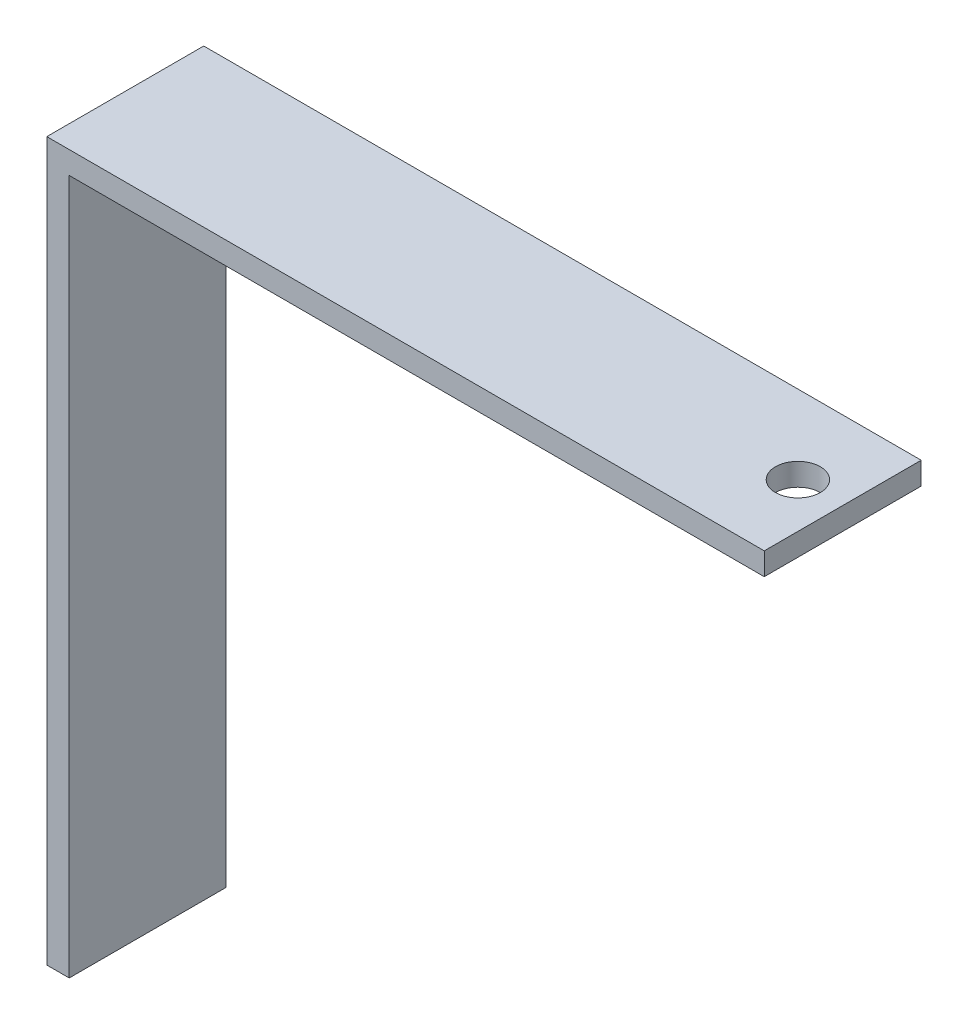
SolidWorks part; units mm, degrees
ref_plane "Front Plane" through (0, 0, 0) normal (0, 0, 1) x (1, 0, 0)
ref_plane "Top Plane" through (0, 0, 0) normal (0, 1, 0) x (1, 0, 0)
ref_plane "Right Plane" through (0, 0, 0) normal (1, 0, 0) x (0, 0, -1)
sketch "Sketch1" plane through (0, 0, 0) normal (0, 0, 1) x (1, 0, 0)
  line L0 (0, 0) -> (0, 101.6)
  line L1 (0, 101.6) -> (101.6, 101.6)
  dimension "D1" = 101.6
extrude "Extrude-Thin1" add sketch "Sketch1" along normal blind 22.225 thin
sketch "Sketch3" plane through (0, 101.6, 0) normal (0, 1, 0) x (1, 0, 0)
  line L0 (0, -22.225) -> (0, 0) construction
  line L1 (106.4523, -11.1125) -> (86.088, -11.1125) construction
  line L2 (101.6, -22.225) -> (101.6, 0) construction
  circle A0 centre (95.25, -11.1125) radius 3.175
  point P8 (101.6, -11.1125)
  dimension "D1" = 6.35
  dimension "D2" = 95.25
extrude "Cut-Extrude1" cut sketch "Sketch3" against normal up to next
